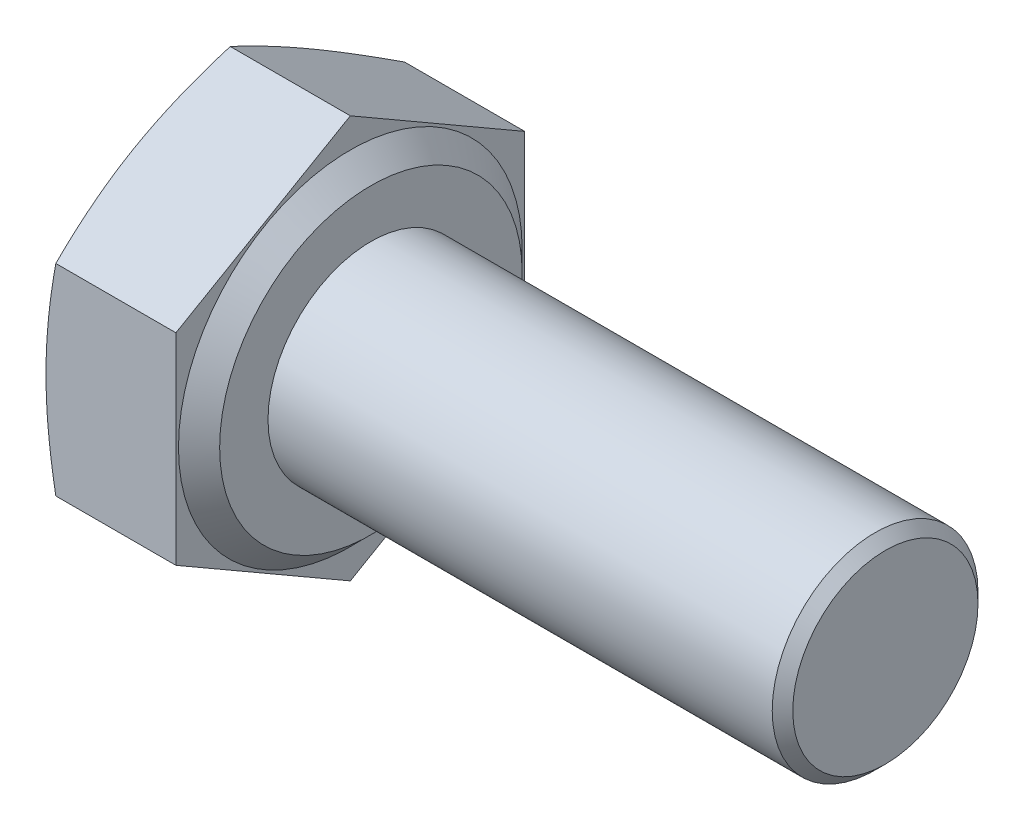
SolidWorks part; units mm, degrees
ref_plane "Front" through (0, 0, 0) normal (0, 0, 1) x (1, 0, 0)
ref_plane "Top" through (0, 0, 0) normal (0, 1, 0) x (1, 0, 0)
ref_plane "Right" through (0, 0, 0) normal (1, 0, 0) x (0, 0, -1)
sketch "Sketch2" plane through (0, 0, 0) normal (1, 0, 0) x (0, 0, -1)
  line L1 (3.39, -1.9572) -> (3.39, 1.9572)
  line L2 (3.39, 1.9572) -> (0, 3.9144)
  line L3 (0, 3.9144) -> (-3.39, 1.9572)
  line L4 (-3.39, 1.9572) -> (-3.39, -1.9572)
  line L5 (-3.39, -1.9572) -> (0, -3.9144)
  line L6 (0, -3.9144) -> (3.39, -1.9572)
  circle A0 centre (0, 0) radius 3.39 construction
  dimension "s" = 6.78
extrude "BaseHead" add sketch "Sketch2" along normal blind 2.925
sketch "Sketch3" plane through (0, 0, 0) normal (0, 0, 1) x (1, 0, 0)
  line L0 (2.925, 3.9144) -> (2.925, 2.94)
  line L2 (2.925, 2.94) -> (2.525, 3.34)
  line L3 (2.525, 3.34) -> (2.525, 3.9144)
  line L5 (2.525, 3.9144) -> (2.925, 3.9144)
  line L6 (-0.9571, 0) -> (7.6478, 0) construction
  line L7 (2.925, 3.9144) -> (0, 3.9144) construction
  dimension "D1" = 45
  dimension "c" = 0.4
  dimension "Dw" = 2.94
revolve "BearingFace" cut sketch "Sketch3" angle 360 about L6
sketch "Sketch4" plane through (0, 0, 0) normal (0, 0, 1) x (1, 0, 0)
  line L0 (-0.4935, 0) -> (3.5626, 0) construction
  line L2 (0, 3.9144) -> (0.1909, 3.9144)
  line L4 (0.1909, 3.9144) -> (0, 3.39)
  line L6 (0, 3.39) -> (0, 3.9144)
  line L7 (2.525, 3.9144) -> (0, 3.9144) construction
  dimension "D1" = 20
  dimension "D2" = 6.78
revolve "HeadChamfer" cut sketch "Sketch4" angle 360 about L0
sketch "Sketch5" plane through (2.925, 0, 0) normal (1, 0, 0) x (0, 0, -1)
  circle A0 centre (0, 0) radius 2
  dimension "d" = 4
extrude "BaseBody" add sketch "Sketch5" along normal blind 10
chamfer "Chamfer1" distance 0.2 angle 45 1 edges at (12.925, 0, -2)
fillet "HeadFillet" [suppressed] radius 0.2
sketch "Sketch6" plane through (0, 0, 0) normal (0, 0, 1) x (1, 0, 0)
  line L0 (2.925, 2.379) -> (3.304, 2.379)
  line L1 (3.304, 2.379) -> (3.304, 2)
  line L2 (3.304, 2) -> (3.1145, 1.6718)
  line L3 (3.1145, 1.6718) -> (2.925, 2)
  line L4 (2.925, 2) -> (2.925, 2.379)
  line L5 (12.725, 2) -> (2.925, 2) construction
  line L6 (2.925, -2.94) -> (2.925, 2.94) construction
  dimension "D1" = 0.379
revolve "Cut-Revolve10" [suppressed] cut sketch "Sketch6" angle 360 about axis through (-0.9571, 0, 0) along (1, 0, 0)
pattern_linear "LPattern10" [suppressed] count 22
equation "\"D2@Sketch4\" = \"s@Sketch2\""
equation "\"D1@Chamfer1\" = 0.05 * \"d@Sketch5\""
equation "\"D1@Sketch6\" =  ( \"d@Sketch5\" - \"D2@ThreadCosmetic1\" )  / 2"
equation "\"pitch@LPattern10\" = \"D1@Sketch6\" * 1.2"
equation "\"D1@LPattern10\" = \"l@BaseBody\" / \"pitch@LPattern10\""
